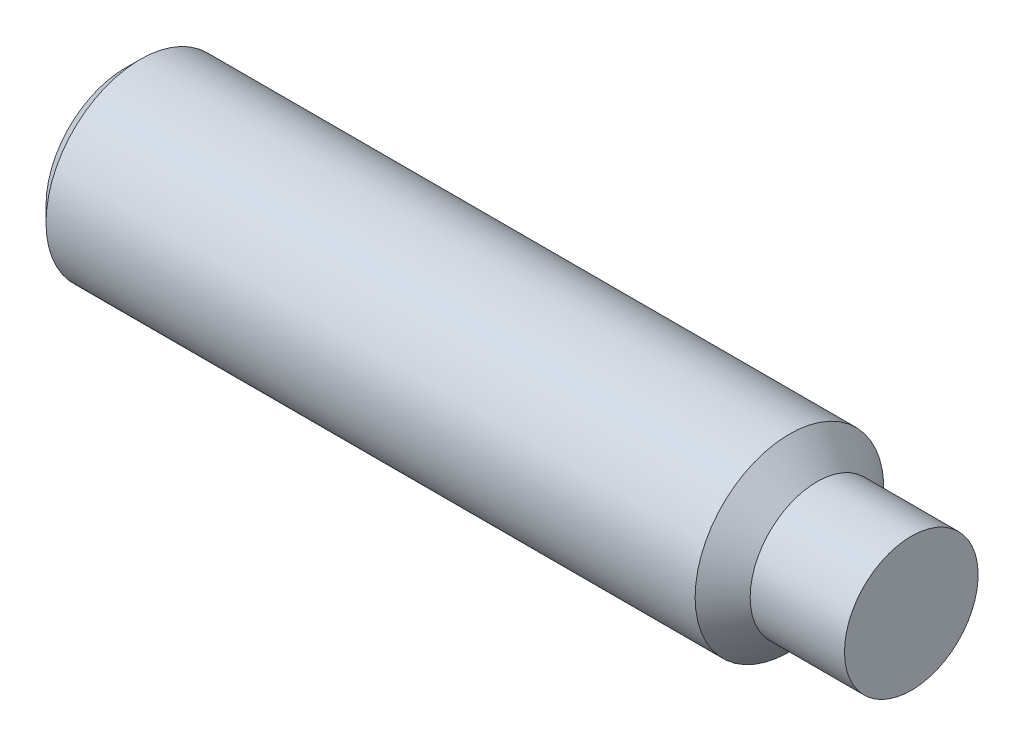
SolidWorks part; units mm, degrees
ref_plane "Front Plane" through (0, 0, 0) normal (0, 0, 1) x (1, 0, 0)
ref_plane "Top Plane" through (0, 0, 0) normal (0, 1, 0) x (1, 0, 0)
ref_plane "Right Plane" through (0, 0, 0) normal (1, 0, 0) x (0, 0, -1)
sketch "BodySke" plane through (0, 0, 0) normal (0, 0, 1) x (1, 0, 0)
  line L0 (0, 0) -> (88.3411, 0) construction
  line L1 (0, 0) -> (0, 5.036)
  line L2 (0, 5.036) -> (0.964, 6)
  line L3 (0.964, 6) -> (42.25, 6)
  line L4 (44, 4.25) -> (42.25, 6)
  line L6 (50, 0) -> (0, 0)
  line L7 (1.75, 0) -> (1.75, 8.5388) construction
  line L8 (0, -5.036) -> (0.964, -6) construction
  line L9 (44, 4.25) -> (50, 4.25)
  line L10 (50, 4.25) -> (50, 0)
  dimension "Diameter" = 12
  dimension "Thread_minor" = 10.072
  dimension "Length" = 50
  dimension "Dog_dia" = 8.5
  dimension "Nose_chamfer_angle" = 45
  dimension "Drive_chamfer_angle" = 90
  dimension "Advance" = 1.75
  dimension "Dog_length" = 6
revolve "BaseBody" add sketch "BodySke" angle 360 about L0
sketch "CountersinkSke" plane through (0, 0, 0) normal (1, 0, 0) x (0, 0, -1)
  line L1 (0, 3.4641) -> (-3, 1.7321)
  line L2 (-3, 1.7321) -> (-3, -1.7321)
  line L3 (-3, -1.7321) -> (0, -3.4641)
  line L4 (0, -3.4641) -> (3, -1.7321)
  line L5 (3, -1.7321) -> (3, 1.7321)
  line L6 (3, 1.7321) -> (0, 3.4641)
  circle A0 centre (0, 0) radius 3 construction
  dimension "Countersink_width" = 6
extrude "Countersink" cut sketch "CountersinkSke" along normal blind 8
sketch "ThdSchSke" plane through (0, 0, 0) normal (0, 0, 1) x (1, 0, 0)
  line L0 (0, 0) -> (53.6961, 0) construction
  line L1 (1.6009, 7.1131) -> (1.6009, 6)
  line L2 (1.6009, 7.1131) -> (2.714, 7.1131)
  line L3 (2.714, 7.1131) -> (2.714, 6)
  line L4 (2.714, 6) -> (2.1574, 5.036)
  line L5 (2.1574, 5.036) -> (1.6009, 6)
  dimension "D1" = 1.75
revolve "ThreadSchematic" [suppressed] cut sketch "ThdSchSke" angle 360 about L0
pattern_linear "ThdSchPat" [suppressed]
equation "\"Thread_minor@ThreadCosmetic\" = \"Thread_minor@BodySke\""
equation "\"D1@ThdSchSke\" = \"Advance@BodySke\""
equation "\"Advance@ThdSchPat\" = \"Advance@BodySke\""
equation "\"Tooth_Num@ThdSchPat\" =  int( (  \"Length@BodySke\" - \"Dog_length@BodySke\" )  / \"Advance@BodySke\" )  - 1"
